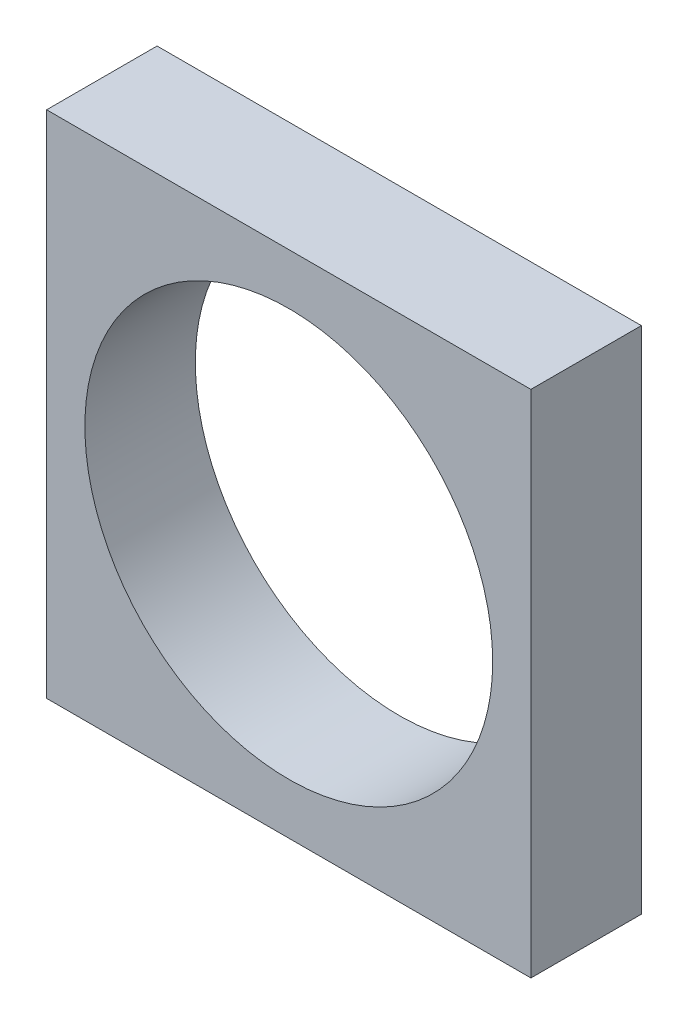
SolidWorks part; units mm, degrees
ref_plane "Plan de face" through (0, 0, 0) normal (0, 0, 1) x (1, 0, 0)
ref_plane "Plan de dessus" through (0, 0, 0) normal (0, 1, 0) x (1, 0, 0)
ref_plane "Plan de droite" through (0, 0, 0) normal (1, 0, 0) x (0, 0, -1)
sketch "Esquisse1" plane through (0, 0, 0) normal (0, 0, 1) x (1, 0, 0)
  line L1 (0, 0) -> (57, 0)
  line L2 (0, 0) -> (0, 60)
  line L3 (0, 60) -> (57, 60)
  line L4 (57, 0) -> (57, 60)
extrude "Extrusion1" add sketch "Esquisse1" along normal blind 13
sketch "Esquisse2" plane through (0, 0, 13) normal (0, 0, 1) x (1, 0, 0)
  circle A0 centre (28.5, 30) radius 24
extrude "Enlèv. mat.-Extru.1" cut sketch "Esquisse2" against normal through all
